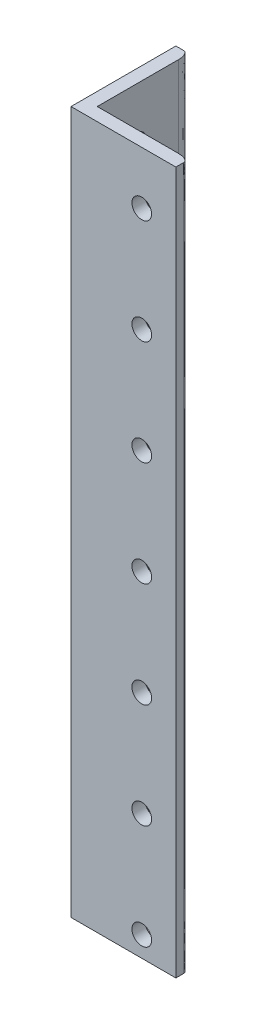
SolidWorks part; units mm, degrees
ref_plane "Front Plane" through (0, 0, 0) normal (0, 0, 1) x (1, 0, 0)
ref_plane "Top Plane" through (0, 0, 0) normal (0, 1, 0) x (1, 0, 0)
ref_plane "Right Plane" through (0, 0, 0) normal (1, 0, 0) x (0, 0, -1)
sketch "Sketch1" plane through (0, 0, 0) normal (0, 1, 0) x (1, 0, 0)
  line L0 (0, 0) -> (0, -25.4)
  line L1 (0, -25.4) -> (25.4, -25.4)
  line L2 (0, 0) -> (3.175, 0)
  line L3 (3.175, 0) -> (3.175, -22.225)
  line L4 (3.175, -22.225) -> (25.4, -22.225)
  line L5 (25.4, -22.225) -> (25.4, -25.4)
  dimension "D1" = 25.4
  dimension "D2" = 25.4
  dimension "D3" = 3.175
  dimension "D4" = 3.175
extrude "Boss-Extrude1" add sketch "Sketch1" along normal blind 170.18
fillet "Fillet1" radius 2.54 1 edges at (3.175, 85.09, 0)
fillet "Fillet2" radius 1.27 1 edges at (25.4, 85.09, 22.225)
sketch "Sketch2" plane through (0, 0, 22.225) normal (0, 0, -1) x (-1, 0, 0)
  line L0 (-25.4, 170.18) -> (-25.4, 0) construction
  line L1 (-22.86, 170.18) -> (-3.175, 170.18) construction
  line L3 (-22.86, 170.18) -> (-22.86, 0) construction
  circle A0 centre (-17.1374, 157.3708) radius 2.3812
  circle A1 centre (-17.1374, 131.9708) radius 2.3812
  circle A2 centre (-17.1374, 106.5708) radius 2.3812
  circle A3 centre (-17.1374, 81.1708) radius 2.3812
  circle A4 centre (-17.1374, 55.7708) radius 2.3812
  circle A5 centre (-17.1374, 30.3708) radius 2.3813
  circle A6 centre (-17.1374, 4.9708) radius 2.3813
  point P22 (-40.582, -3.022)
  dimension "D1" = 4.7625
  dimension "D6" = 4.7625
  dimension "D7" = 25.4
  dimension "D8" = 5.7226
  dimension "D2" = 8.2626
  dimension "D3" = 12.8092
  dimension "D5" = 25.4
  dimension "D4" = 6
extrude "Cut-Extrude1" cut sketch "Sketch2" against normal blind 3.175
sketch "Sketch3" plane through (3.175, 0, 0) normal (1, 0, 0) x (0, 0, -1)
  line L0 (0, 170.18) -> (0, 0) construction
  line L2 (-22.225, 170.18) -> (-2.54, 170.18) construction
  line L4 (0, 170.18) -> (0, 0) construction
  circle A0 centre (-12.7, 157.48) radius 2.3812
  circle A1 centre (-12.7, 132.08) radius 2.3812
  circle A2 centre (-12.7, 106.68) radius 2.3812
  circle A3 centre (-12.7, 81.28) radius 2.3812
  circle A4 centre (-12.7, 55.88) radius 2.3812
  circle A5 centre (-12.7, 30.48) radius 2.3813
  circle A6 centre (-12.7, 5.08) radius 2.3813
  dimension "D1" = 4.7625
  dimension "D6" = 4.7625
  dimension "D7" = 25.4
  dimension "D8" = 12.7
  dimension "D2" = 12.7
  dimension "D3" = 12.7
  dimension "D5" = 25.4
  dimension "D4" = 6
extrude "Cut-Extrude2" cut sketch "Sketch3" against normal blind 3.175
